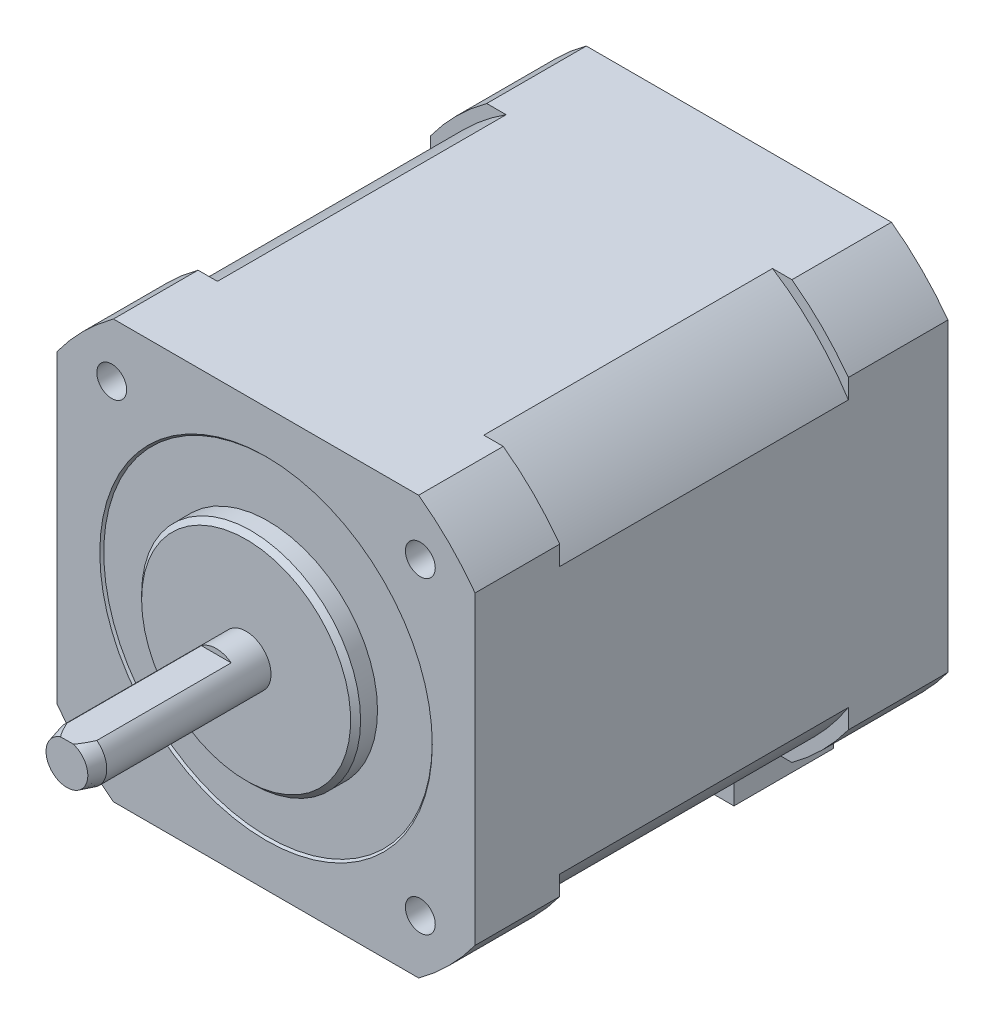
SolidWorks part; units mm, degrees
ref_plane "正面" through (0, 0, 0) normal (0, 0, 1) x (1, 0, 0)
ref_plane "平面" through (0, 0, 0) normal (0, 1, 0) x (1, 0, 0)
ref_plane "右側面" through (0, 0, 0) normal (1, 0, 0) x (0, 0, -1)
sketch "ｽｹｯﾁ1" plane through (0, 0, 0) normal (0, 0, 1) x (1, 0, 0)
  circle A0 centre (0, 0) radius 2.5
  dimension "D1" = 5
extrude "押し出し1" add sketch "ｽｹｯﾁ1" along normal blind 18
sketch "ｽｹｯﾁ2" plane through (0, 0, 0) normal (0, 0, -1) x (-1, 0, 0)
  circle A0 centre (0, 0) radius 11
  dimension "D1" = 22
extrude "押し出し2" add sketch "ｽｹｯﾁ2" along normal blind 2
sketch "ｽｹｯﾁ3" plane through (0, 0, -2) normal (0, 0, -1) x (-1, 0, 0)
  line L1 (-21, 21) -> (21, 21)
  line L2 (-21, 21) -> (-21, -21)
  line L3 (-21, -21) -> (21, -21)
  line L4 (21, 21) -> (21, -21)
  line L5 (-21, 21) -> (21, -21) construction
  line L6 (-21, -21) -> (21, 21) construction
  point P0 (0, 0)
  point P6 (0, 0)
  dimension "D1" = 42
  dimension "D2" = 42
extrude "押し出し3" add sketch "ｽｹｯﾁ3" along normal blind 8.5
sketch "Sketch8" plane through (0, 0, -2) normal (0, 0, 1) x (1, 0, 0)
  circle A0 centre (0, 0) radius 26
  dimension "D1" = 52
extrude "Extrude8" cut sketch "Sketch8" against normal blind 34 flip side to cut
sketch "Sketch16" plane through (0, 0, -2) normal (0, 0, 1) x (1, 0, 0)
  circle A0 centre (-15.5, 15.5) radius 1.5
  circle A1 centre (15.5, 15.5) radius 1.5
  circle A2 centre (15.5, -15.5) radius 1.5
  circle A3 centre (-15.5, -15.5) radius 1.5
  dimension "D1" = 3
  dimension "D2" = 3
  dimension "D3" = 3
  dimension "D4" = 3
  dimension "D5" = 15.5
  dimension "D6" = 31
  dimension "D7" = 15.5
  dimension "D8" = 31
  dimension "D9" = 15.5
  dimension "D10" = 31
  dimension "D11" = 15.5
  dimension "D12" = 31
extrude "Extrude15" cut sketch "Sketch16" against normal blind 4.5
sketch "Sketch9" plane through (0, 0, -10.5) normal (0, 0, -1) x (-1, 0, 0)
  line L4 (-21, 15.3297) -> (-21, -15.3297) construction
  line L5 (-15.3297, -21) -> (15.3297, -21) construction
  line L6 (21, -15.3297) -> (21, 15.3297) construction
  line L7 (15.3297, 21) -> (-15.3297, 21) construction
  line L8 (-21, 13.3795) -> (-21, -13.3795)
  line L9 (-13.3795, -21) -> (13.3795, -21)
  line L10 (21, -13.3795) -> (21, 13.3795)
  line L11 (13.3795, 21) -> (-13.3795, 21)
  arc A1 (21, 13.3795) -> (13.3795, 21) centre (0, 0) ccw
  arc A2 (-13.3795, 21) -> (-21, 13.3795) centre (0, 0) ccw
  arc A3 (-21, -13.3795) -> (-13.3795, -21) centre (0, 0) ccw
  arc A4 (13.3795, -21) -> (21, -13.3795) centre (0, 0) ccw
  dimension "D1" = 49.8
extrude "Extrude9" add sketch "Sketch9" along normal blind 29
sketch "Sketch11" plane through (0, 0, -39.5) normal (0, 0, -1) x (-1, 0, 0)
  line L0 (-21, 13.3795) -> (-21, -13.3795) construction
  line L1 (-21, 15.3297) -> (-21, 13.3795) construction
  line L2 (-21, -13.3795) -> (-21, -15.3297) construction
  line L3 (-13.3795, -21) -> (13.3795, -21) construction
  line L4 (-15.3297, -21) -> (-13.3795, -21) construction
  line L5 (13.3795, -21) -> (15.3297, -21) construction
  line L6 (21, -15.3297) -> (21, -13.3795) construction
  line L7 (21, -13.3795) -> (21, 13.3795) construction
  line L8 (21, 13.3795) -> (21, 15.3297) construction
  line L9 (15.3297, 21) -> (13.3795, 21) construction
  line L10 (-13.3795, 21) -> (-15.3297, 21) construction
  line L11 (-21, 13.3795) -> (-21, -13.3795)
  line L12 (-21, 15.3297) -> (-21, 13.3795)
  line L13 (-21, -13.3795) -> (-21, -15.3297)
  line L14 (-13.3795, -21) -> (13.3795, -21)
  line L15 (-15.3297, -21) -> (-13.3795, -21)
  line L16 (13.3795, -21) -> (15.3297, -21)
  line L17 (21, -15.3297) -> (21, -13.3795)
  line L18 (21, -13.3795) -> (21, 13.3795)
  line L19 (21, 13.3795) -> (21, 15.3297)
  line L20 (15.3297, 21) -> (13.3795, 21)
  line L21 (-13.3795, 21) -> (-15.3297, 21)
  line L22 (13.3795, 21) -> (-13.3795, 21) construction
  line L23 (13.3795, 21) -> (-13.3795, 21)
  arc A0 (-15.3297, 21) -> (-21, 15.3297) centre (0, 0) ccw construction
  arc A1 (-21, -15.3297) -> (-15.3297, -21) centre (0, 0) ccw construction
  arc A2 (15.3297, -21) -> (21, -15.3297) centre (0, 0) ccw construction
  arc A3 (21, 15.3297) -> (15.3297, 21) centre (0, 0) ccw construction
  arc A4 (-15.3297, 21) -> (-21, 15.3297) centre (0, 0) ccw
  arc A5 (-21, -15.3297) -> (-15.3297, -21) centre (0, 0) ccw
  arc A6 (15.3297, -21) -> (21, -15.3297) centre (0, 0) ccw
  arc A7 (21, 15.3297) -> (15.3297, 21) centre (0, 0) ccw
extrude "Extrude11" add sketch "Sketch11" along normal blind 10
chamfer "Chamfer5" distance 1.5 angle 15 1 edges at (2.5, 0, 18)
sketch "Sketch2" plane through (0, 0, 18) normal (0, 0, 1) x (1, 0, 0)
  line L1 (-4.7278, 5.1185) -> (3.4221, 5.1185)
  line L2 (-4.7278, 5.1185) -> (-4.7278, 2)
  line L3 (-4.7278, 2) -> (3.4221, 2)
  line L4 (3.4221, 5.1185) -> (3.4221, 2)
  dimension "D1" = 2
extrude "Extrude2" cut sketch "Sketch2" against normal blind 15
sketch "Sketch6" plane through (0, 0, -2) normal (0, 0, 1) x (1, 0, 0)
  circle A0 centre (0, 0) radius 16.5
  circle A1 centre (0, 0) radius 11 construction
  circle A2 centre (0, 0) radius 11
  dimension "D2" = 33
extrude "Extrude6" cut sketch "Sketch6" against normal blind 0.2
chamfer "Chamfer2" distance 0.5 angle 45 1 edges at (-11, 0, 0)
chamfer "Chamfer7" distance 0.2 angle 45 1 edges at (16.5, 0, -2)
sketch "Sketch13" plane through (0, -21, 0) normal (0, -1, 0) x (1, 0, 0)
  line L0 (15.3297, -49.5) -> (-15.3297, -49.5) construction
  line L1 (-9.5, -39.5) -> (9.5, -39.5)
  line L2 (-9.5, -39.5) -> (-9.5, -49.5)
  line L3 (-9.5, -49.5) -> (9.5, -49.5)
  line L4 (9.5, -39.5) -> (9.5, -49.5)
  line L5 (-21, -49.5) -> (-21, -39.5) construction
  dimension "D1" = 10
  dimension "11.5" = 11.5
  dimension "D2" = 19
extrude "Extrude12" add sketch "Sketch13" along normal blind 6.7
sketch "Sketch14" plane through (0, 0, -49.5) normal (0, 0, -1) x (-1, 0, 0)
  circle A0 centre (0, 0) radius 2.5
extrude "Extrude13" add sketch "Sketch14" along normal blind 15
chamfer "Chamfer8" distance 1.5 angle 15 1 edges at (-2.5, 0, -64.5)
sketch "Sketch15" plane through (0, 0, -64.5) normal (0, 0, -1) x (-1, 0, 0)
  line L0 (0, 0) -> (-7.0229, 0) construction
  line L1 (-5, 4) -> (5, 4)
  line L2 (-5, 4) -> (-5, 2)
  line L3 (-5, 2) -> (5, 2)
  line L4 (5, 4) -> (5, 2)
  line L5 (0, 0) -> (0, 9.1437) construction
  dimension "D1" = 10
  dimension "D2" = 2
  dimension "D3" = 5
  dimension "D4" = 2
extrude "Extrude14" cut sketch "Sketch15" against normal blind 15
